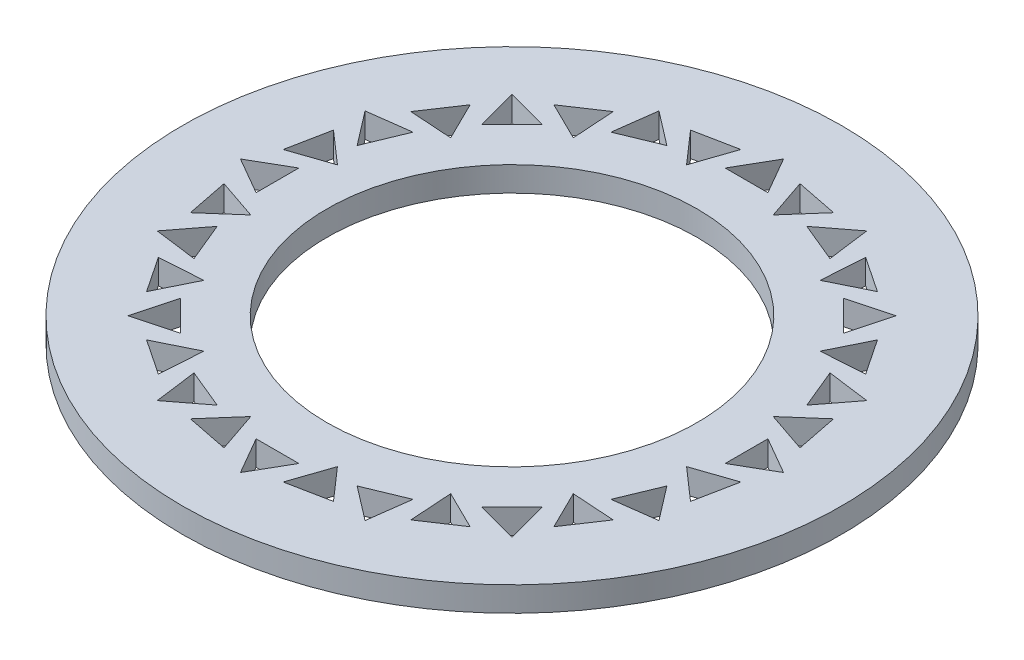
SolidWorks part; units mm, degrees
ref_plane "Front Plane" through (0, 0, 0) normal (0, 0, 1) x (1, 0, 0)
ref_plane "Top Plane" through (0, 0, 0) normal (0, 1, 0) x (1, 0, 0)
ref_plane "Right Plane" through (0, 0, 0) normal (1, 0, 0) x (0, 0, -1)
sketch "Sketch1" plane through (0, 0, 0) normal (0, 1, 0) x (1, 0, 0)
  circle A0 centre (0, 0) radius 7.5
  circle A1 centre (0, 0) radius 13.35
  dimension "D1" = 26.7
  dimension "D2" = 15
extrude "Boss-Extrude1" add sketch "Sketch1" along normal blind 1
sketch "Sketch3" plane through (0, 1, 0) normal (0, 1, 0) x (1, 0, 0)
  line L0 (4.2095, 10.1627) -> (2.8354, 9.1083)
  line L1 (0, 11) -> (-0.866, 9.5)
  line L2 (-0.866, 9.5) -> (0.866, 9.5)
  line L3 (0.866, 9.5) -> (0, 11)
  line L4 (2.8354, 9.1083) -> (4.4356, 8.4454)
  line L5 (4.4356, 8.4454) -> (4.2095, 10.1627)
  line L6 (7.7782, 7.7782) -> (6.1051, 7.3299)
  line L7 (6.1051, 7.3299) -> (7.3299, 6.1051)
  line L8 (7.3299, 6.1051) -> (7.7782, 7.7782)
  line L9 (10.1627, 4.2095) -> (8.4454, 4.4356)
  line L10 (8.4454, 4.4356) -> (9.1083, 2.8354)
  line L11 (9.1083, 2.8354) -> (10.1627, 4.2095)
  line L12 (11, 0) -> (9.5, 0.866)
  line L13 (9.5, 0.866) -> (9.5, -0.866)
  line L14 (9.5, -0.866) -> (11, 0)
  line L15 (10.1627, -4.2095) -> (9.1083, -2.8354)
  line L16 (9.1083, -2.8354) -> (8.4454, -4.4356)
  line L17 (8.4454, -4.4356) -> (10.1627, -4.2095)
  line L18 (7.7782, -7.7782) -> (7.3299, -6.1051)
  line L19 (7.3299, -6.1051) -> (6.1051, -7.3299)
  line L20 (6.1051, -7.3299) -> (7.7782, -7.7782)
  line L21 (4.2095, -10.1627) -> (4.4356, -8.4454)
  line L22 (4.4356, -8.4454) -> (2.8354, -9.1083)
  line L23 (2.8354, -9.1083) -> (4.2095, -10.1627)
  line L24 (0, -11) -> (0.866, -9.5)
  line L25 (0.866, -9.5) -> (-0.866, -9.5)
  line L26 (-0.866, -9.5) -> (0, -11)
  line L27 (-4.2095, -10.1627) -> (-2.8354, -9.1083)
  line L28 (-2.8354, -9.1083) -> (-4.4356, -8.4454)
  line L29 (-4.4356, -8.4454) -> (-4.2095, -10.1627)
  line L30 (-7.7782, -7.7782) -> (-6.1051, -7.3299)
  line L31 (-6.1051, -7.3299) -> (-7.3299, -6.1051)
  line L32 (-7.3299, -6.1051) -> (-7.7782, -7.7782)
  line L33 (-10.1627, -4.2095) -> (-8.4454, -4.4356)
  line L34 (-8.4454, -4.4356) -> (-9.1083, -2.8354)
  line L35 (-9.1083, -2.8354) -> (-10.1627, -4.2095)
  line L36 (-11, 0) -> (-9.5, -0.866)
  line L37 (-9.5, -0.866) -> (-9.5, 0.866)
  line L38 (-9.5, 0.866) -> (-11, 0)
  line L39 (-10.1627, 4.2095) -> (-9.1083, 2.8354)
  line L40 (-9.1083, 2.8354) -> (-8.4454, 4.4356)
  line L41 (-8.4454, 4.4356) -> (-10.1627, 4.2095)
  line L42 (-7.7782, 7.7782) -> (-7.3299, 6.1051)
  line L43 (-7.3299, 6.1051) -> (-6.1051, 7.3299)
  line L44 (-6.1051, 7.3299) -> (-7.7782, 7.7782)
  line L45 (-4.2095, 10.1627) -> (-4.4356, 8.4454)
  line L46 (-4.4356, 8.4454) -> (-2.8354, 9.1083)
  line L47 (-2.8354, 9.1083) -> (-4.2095, 10.1627)
  line L48 (0, 10) -> (0, 0) construction
  line L49 (0, 0) -> (4.2095, 10.1627) construction
  line L50 (0, 0) -> (1.9509, 9.8079) construction
  line L51 (5.0001, 7.4832) -> (6.5536, 8.2493)
  line L52 (1.7558, 8.8271) -> (2.8978, 10.1293)
  line L53 (2.8978, 10.1293) -> (1.1991, 10.4672)
  line L54 (1.1991, 10.4672) -> (1.7558, 8.8271)
  line L55 (6.5536, 8.2493) -> (5.1134, 9.2116)
  line L56 (5.1134, 9.2116) -> (5.0001, 7.4832)
  line L57 (7.4832, 5.0001) -> (9.2116, 5.1134)
  line L58 (9.2116, 5.1134) -> (8.2493, 6.5536)
  line L59 (8.2493, 6.5536) -> (7.4832, 5.0001)
  line L60 (8.8271, 1.7558) -> (10.4672, 1.1991)
  line L61 (10.4672, 1.1991) -> (10.1293, 2.8978)
  line L62 (10.1293, 2.8978) -> (8.8271, 1.7558)
  line L63 (8.8271, -1.7558) -> (10.1293, -2.8978)
  line L64 (10.1293, -2.8978) -> (10.4672, -1.1991)
  line L65 (10.4672, -1.1991) -> (8.8271, -1.7558)
  line L66 (7.4832, -5.0001) -> (8.2493, -6.5536)
  line L67 (8.2493, -6.5536) -> (9.2116, -5.1134)
  line L68 (9.2116, -5.1134) -> (7.4832, -5.0001)
  line L69 (5.0001, -7.4832) -> (5.1134, -9.2116)
  line L70 (5.1134, -9.2116) -> (6.5536, -8.2493)
  line L71 (6.5536, -8.2493) -> (5.0001, -7.4832)
  line L72 (1.7558, -8.8271) -> (1.1991, -10.4672)
  line L73 (1.1991, -10.4672) -> (2.8978, -10.1293)
  line L74 (2.8978, -10.1293) -> (1.7558, -8.8271)
  line L75 (-1.7558, -8.8271) -> (-2.8978, -10.1293)
  line L76 (-2.8978, -10.1293) -> (-1.1991, -10.4672)
  line L77 (-1.1991, -10.4672) -> (-1.7558, -8.8271)
  line L78 (-5.0001, -7.4832) -> (-6.5536, -8.2493)
  line L79 (-6.5536, -8.2493) -> (-5.1134, -9.2116)
  line L80 (-5.1134, -9.2116) -> (-5.0001, -7.4832)
  line L81 (-7.4832, -5.0001) -> (-9.2116, -5.1134)
  line L82 (-9.2116, -5.1134) -> (-8.2493, -6.5536)
  line L83 (-8.2493, -6.5536) -> (-7.4832, -5.0001)
  line L84 (-8.8271, -1.7558) -> (-10.4672, -1.1991)
  line L85 (-10.4672, -1.1991) -> (-10.1293, -2.8978)
  line L86 (-10.1293, -2.8978) -> (-8.8271, -1.7558)
  line L87 (-8.8271, 1.7558) -> (-10.1293, 2.8978)
  line L88 (-10.1293, 2.8978) -> (-10.4672, 1.1991)
  line L89 (-10.4672, 1.1991) -> (-8.8271, 1.7558)
  line L90 (-7.4832, 5.0001) -> (-8.2493, 6.5536)
  line L91 (-8.2493, 6.5536) -> (-9.2116, 5.1134)
  line L92 (-9.2116, 5.1134) -> (-7.4832, 5.0001)
  line L93 (-5.0001, 7.4832) -> (-5.1134, 9.2116)
  line L94 (-5.1134, 9.2116) -> (-6.5536, 8.2493)
  line L95 (-6.5536, 8.2493) -> (-5.0001, 7.4832)
  line L96 (-1.7558, 8.8271) -> (-1.1991, 10.4672)
  line L97 (-1.1991, 10.4672) -> (-2.8978, 10.1293)
  line L98 (-2.8978, 10.1293) -> (-1.7558, 8.8271)
  circle A0 centre (0, 0) radius 10 construction
  circle A1 centre (0, 10) radius 0.5 construction
  circle A2 centre (1.9509, 9.8079) radius 0.5 construction
  point P56 (0, 0)
  point P107 (0, 0)
  dimension "D1" = 20
  dimension "D2" = 1
  dimension "D6" = 1
  dimension "D4" = 22.5
  dimension "D5" = 11.25
  dimension "D3" = 16
  dimension "D7" = 16
extrude "Cut-Extrude1" cut sketch "Sketch3" against normal blind 3
